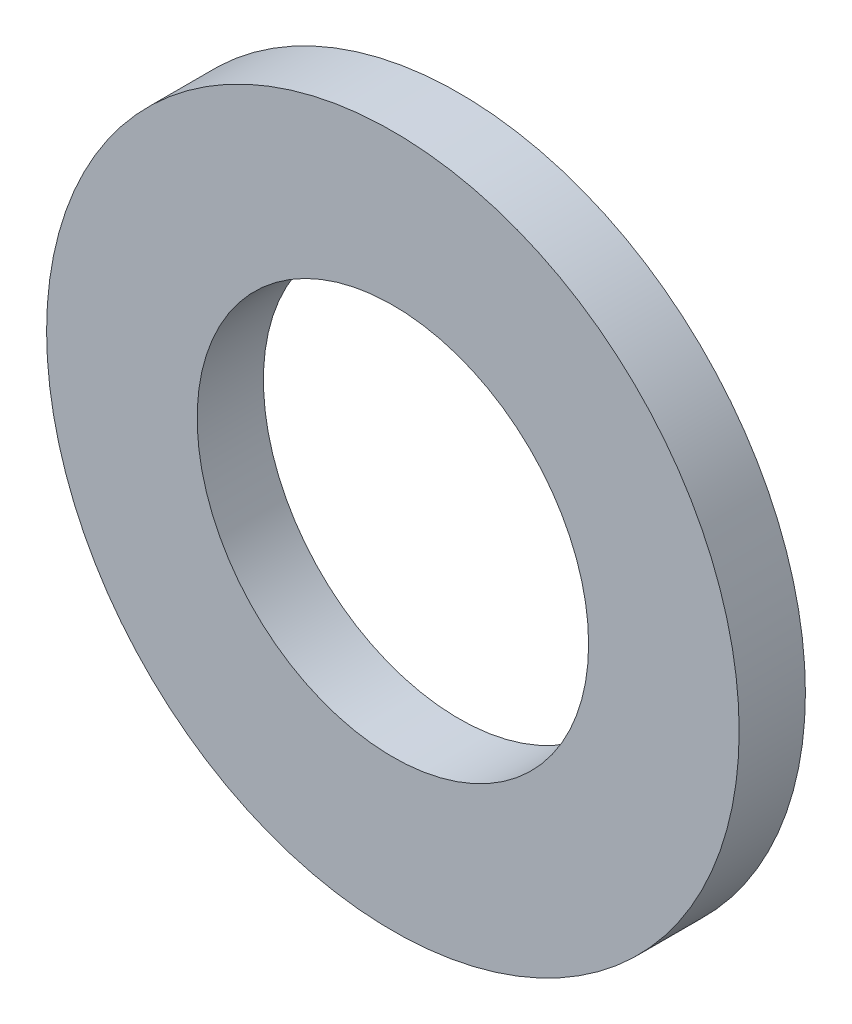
SolidWorks part; units mm, degrees
ref_plane "Plan de face" through (0, 0, 0) normal (0, 0, 1) x (1, 0, 0)
ref_plane "Plan de dessus" through (0, 0, 0) normal (0, 1, 0) x (1, 0, 0)
ref_plane "Plan de droite" through (0, 0, 0) normal (1, 0, 0) x (0, 0, -1)
sketch "Esquisse1" plane through (0, 0, 0) normal (0, 0, 1) x (1, 0, 0)
  circle A0 centre (0, 0) radius 6.5
  circle A1 centre (0, 0) radius 11.5
  dimension "D1" = 13
  dimension "D2" = 23
extrude "Extrusion1" add sketch "Esquisse1" along normal blind 2.2
